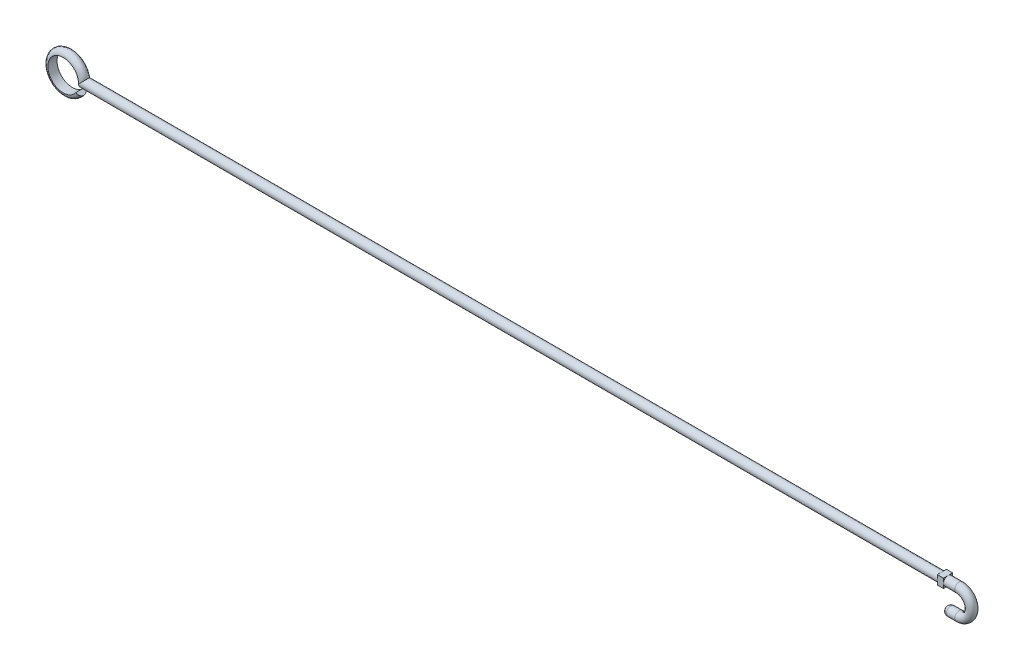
SolidWorks part; units mm, degrees
ref_plane "Plan de face" through (0, 0, 0) normal (0, 0, 1) x (1, 0, 0)
ref_plane "Plan de dessus" through (0, 0, 0) normal (0, 1, 0) x (1, 0, 0)
ref_plane "Plan de droite" through (0, 0, 0) normal (1, 0, 0) x (0, 0, -1)
sketch "Esquisse1" plane through (0, 0, 0) normal (0, 0, 1) x (1, 0, 0)
  line L0 (0, 0) -> (-140, 0)
  arc A0 (-140, 0) -> (-140.4564, -1.44) centre (-142.5, 0) ccw
  dimension "D1" = 2.5
  dimension "D3" = 140
sketch "Esquisse2" plane through (0, 0, 0) normal (1, 0, 0) x (0, 0, -1)
  circle A0 centre (0, 0) radius 0.75
  dimension "D1" = 1.5
sweep "Balayage1" add profiles "Esquisse2" path "Esquisse1"
sketch "Esquisse3" plane through (0, 0, 0) normal (0, 0, 1) x (1, 0, 0)
  circle A0 centre (-142.5, 0) radius 2.5
  dimension "D1" = 5
  dimension "D2" = 142.5
extrude "Enlèv. mat.-Extru.1" cut sketch "Esquisse3" against normal through all both and the other way through all
sketch "Esquisse4" plane through (0, 0, 0) normal (1, 0, 0) x (0, 0, -1)
  line L1 (-0.75, 0.7357) -> (0.75, 0.7357)
  line L2 (-0.75, 0.7357) -> (-0.75, -0.7357)
  line L3 (-0.75, -0.7357) -> (0.75, -0.7357)
  line L4 (0.75, 0.7357) -> (0.75, -0.7357)
  line L5 (-0.75, 0.7357) -> (0.75, -0.7357) construction
  line L6 (-0.75, -0.7357) -> (0.75, 0.7357) construction
  spline S0 degree 3 poles (0.75, 0.5112) (0.75, 0.3775) (0.75, 0.242) (0.75, -0.0326) (0.75, -0.1715) (0.75, -0.4427) (0.75, -0.5763) (0.75, -0.8397) (0.75, -0.9694) (0.75, -1.2153) (0.75, -1.3328) (0.75, -1.5567) (0.75, -1.6633) (0.75, -1.8575) (0.75, -1.9463) (0.75, -2.1068) (0.75, -2.1788) (0.75, -2.2396) knots 0 0 0 0 0.125 0.125 0.25 0.25 0.375 0.375 0.5 0.5 0.625 0.625 0.75 0.75 0.875 0.875 1 1 1 1 construction
  point P0 (0, 0)
extrude "Boss.-Extru.1" add sketch "Esquisse4" along normal blind 1
sketch "Esquisse6" plane through (0, 0, 0.75) normal (0, 0, 1) x (1, 0, 0)
  line L0 (0, 0) -> (2.8277, 0)
  line L1 (2.8277, -4.0465) -> (0.7786, -4.0465)
  arc A0 (2.8277, 0) -> (2.8277, -4.0465) centre (2.8277, -2.0232) cw
sketch "Esquisse7" plane through (1, 0, 0) normal (1, 0, 0) x (0, 0, -1)
  circle A0 centre (0, 0) radius 0.7357
sweep "Balayage2" add profiles "Esquisse7" path "Esquisse6"
fillet "Congé2" radius 0.7 1 edges at (0.7786, -4.0465, -0.7357)
